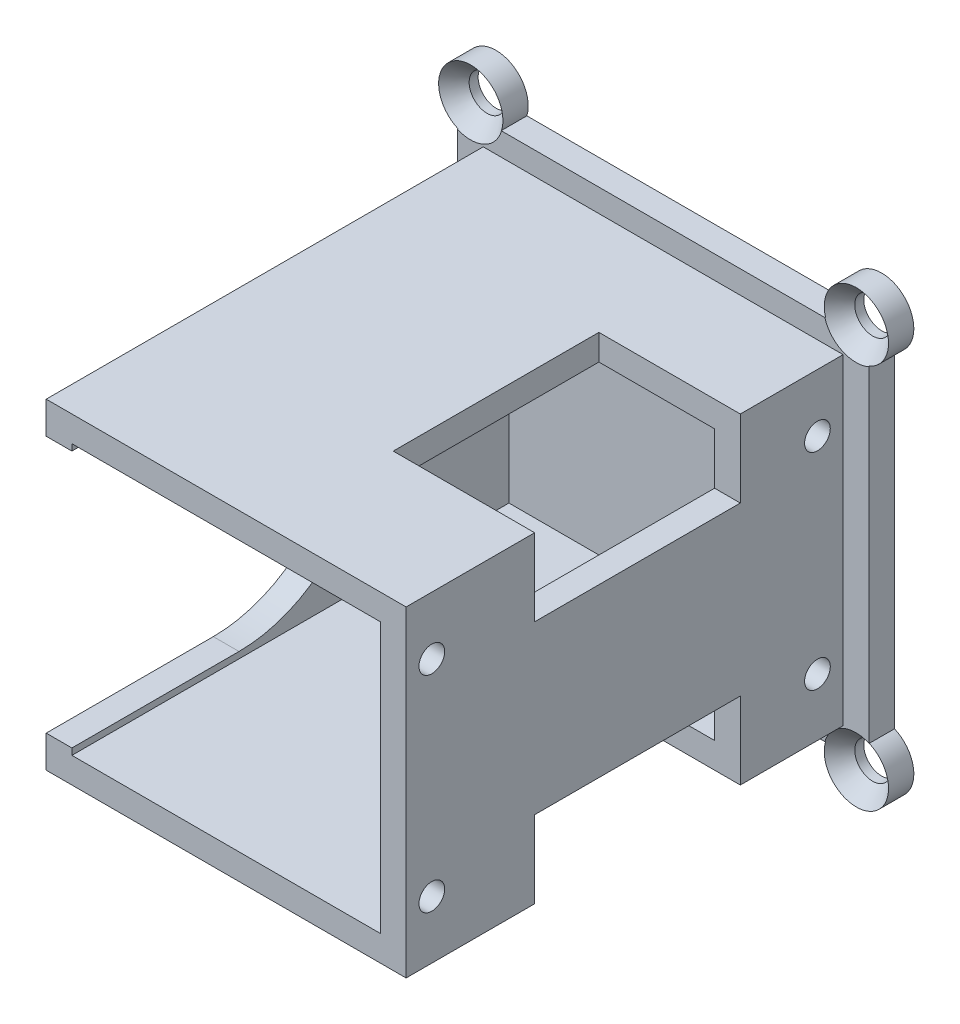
SolidWorks part; units mm, degrees
ref_plane "Ebene vorne" through (0, 0, 0) normal (0, 0, 1) x (1, 0, 0)
ref_plane "Ebene oben" through (0, 0, 0) normal (0, 1, 0) x (1, 0, 0)
ref_plane "Ebene rechts" through (0, 0, 0) normal (1, 0, 0) x (0, 0, -1)
sketch "Skizze1" plane through (0, 0, 0) normal (0, 0, 1) x (1, 0, 0)
  line L1 (-14, -12.5) -> (14, -12.5)
  line L2 (-14, -12.5) -> (-14, 12.5)
  line L3 (-14, 12.5) -> (14, 12.5)
  line L4 (14, -12.5) -> (14, 12.5)
  line L5 (-14, -12.5) -> (14, 12.5) construction
  line L6 (-14, 12.5) -> (14, -12.5) construction
  line L7 (-12, -10.5) -> (12, -10.5)
  line L8 (-12, -10.5) -> (-12, 10.5)
  line L9 (-12, 10.5) -> (12, 10.5)
  line L10 (12, -10.5) -> (12, 10.5)
  line L11 (-12, -10.5) -> (12, 10.5) construction
  line L12 (-12, 10.5) -> (12, -10.5) construction
  point P0 (0, 0)
  point P6 (0, 0)
  dimension "D1" = 2
  dimension "D2" = 2
  dimension "D3" = 24
  dimension "D4" = 21
extrude "Aufsatz-Linear austragen1" add sketch "Skizze1" along normal blind 36
sketch "Skizze2" plane through (0, 0, 0) normal (0, 0, 1) x (1, 0, 0)
  line L1 (-14, -12.5) -> (14, -12.5)
  line L2 (-14, -12.5) -> (-14, 12.5)
  line L3 (-14, 12.5) -> (14, 12.5)
  line L4 (14, -12.5) -> (14, 12.5)
  line L5 (-14, -12.5) -> (14, 12.5) construction
  line L6 (-14, 12.5) -> (14, -12.5) construction
  point P0 (0, 0)
extrude "Aufsatz-Linear austragen2" add sketch "Skizze2" along normal blind 2
sketch "Skizze4" plane through (0, 0, 0) normal (1, 0, 0) x (0, 0, -1)
  line L0 (-36, -12.5) -> (-36, 12.5) construction
  line L1 (-23, -10) -> (-36, -10)
  line L2 (-23, 10) -> (-36, 10)
  line L3 (-36, 10) -> (-36, -10)
  arc A0 (-23, -10) -> (-23, 10) centre (-23, 0) ccw
  dimension "D1" = 13
  dimension "D2" = 20
extrude "Schnitt-Linear austragen1" cut sketch "Skizze4" along normal up to surface (2 mm away) from surface at -14
sketch "Skizze6" plane through (0, 0, 0) normal (0, 0, 1) x (1, 0, 0)
  line L0 (-12.1518, -12.8474) -> (13.6136, 14.3929) construction
  line L1 (-13.9386, 12.4451) -> (13.9866, -12.488) construction
  line L2 (-15, 15) -> (15, -15) construction
  line L3 (15, 15) -> (-15, -15) construction
  line L4 (-15, -15) -> (15, -15) construction
  line L5 (-15, -15) -> (-15, 15) construction
  line L6 (-15, 15) -> (15, 15) construction
  line L7 (15, -15) -> (15, 15) construction
  circle A0 centre (-15, -15) radius 2.5
  point P2 (0, 0)
  dimension "D3" = 5
  dimension "D1" = 30
  dimension "D2" = 30
extrude "Aufsatz-Linear austragen3" add sketch "Skizze6" along normal blind 2
sketch "Skizze10" plane through (0, 0, 0) normal (0, 0, 1) x (1, 0, 0)
  line L0 (-14, 10) -> (-14, -10) construction
  line L1 (-16, -14.2857) -> (16, -14.2857)
  line L2 (-16, -14.2857) -> (-16, 14.2857)
  line L3 (-16, 14.2857) -> (16, 14.2857)
  line L4 (16, -14.2857) -> (16, 14.2857)
  line L5 (-16, -14.2857) -> (16, 14.2857) construction
  line L6 (-16, 14.2857) -> (16, -14.2857) construction
  point P0 (0, 0)
  dimension "D1" = 2
extrude "Aufsatz-Linear austragen4" add sketch "Skizze10" along normal blind 2
hole_wizard "Formsenkung für #3 Linsensenkschraube1" positions "3D-Skizze1" profile "Skizze8" countersink size "#3" standard "ANSI Inch"
sketch3d "3D-Skizze1"
  line L0 (-15, -15, 2) -> (-15, -15, 0) construction
  point P0 (-15, -15, 2)
sketch "Skizze8" plane through (-15, -15, 2) normal (1, 0, 0) x (0, -1, 0)
  line L0 (0, 0) -> (0, 2)
  line L1 (0, 2) -> (1.397, 2)
  line L2 (1.397, 2) -> (1.397, 1.3003)
  line L3 (1.397, 1.3003) -> (2.5273, 0)
  line L5 (2.5273, 0) -> (0, 0)
  line L6 (-1.397, 1.3003) -> (-2.5273, 0) construction
  line L11 (0, -6.35) -> (0, 107.95) construction
  dimension "Bohrerdurchmesser" = 2.794
  dimension "Bohrungstiefe" = 2
  dimension "Senkdurchmesser (Oben)" = 5.0546
  dimension "Senkwinkel (Oben)" = 82
mirror "Spiegeln6" about plane through (0, 0, 0) normal (1, 0, 0) of "Aufsatz-Linear austragen3", "Formsenkung für #3 Linsensenkschraube1"
sketch "Skizze12" plane through (0, 0, 0) normal (1, 0, 0) x (0, 0, -1)
  line L0 (-36, 12.5) -> (-2, 12.5) construction
  line L1 (-26, 12.5) -> (-10, 12.5)
  line L2 (-26, 12.5) -> (-26, 6.5)
  line L3 (-26, 6.5) -> (-10, 6.5)
  line L4 (-10, 12.5) -> (-10, 6.5)
  line L5 (-36, -12.5) -> (-36, 12.5) construction
  line L6 (-2, 12.5) -> (-2, -12.5) construction
  dimension "D1" = 6
  dimension "D2" = 10
  dimension "D3" = 8
extrude "Schnitt-Linear austragen2" cut sketch "Skizze12" against normal blind 11 from surface at 14
mirror "Spiegeln7" about plane through (0, 0, 0) normal (0, 1, 0) of "Schnitt-Linear austragen2"
sketch "Sketch1" plane through (14, 0, 0) normal (1, 0, 0) x (0, 0, -1)
  line L0 (-36, 0) -> (3.5916, 0) construction
  line L1 (-36, -12.5) -> (-36, 12.5) construction
  line L2 (-34, -8) -> (-34, 8) construction
  line L3 (-4, -8.0174) -> (-4, 8.0174) construction
  circle A0 centre (-34, 8) radius 1
  circle A1 centre (-34, -8) radius 1
  circle A2 centre (-4, 8.0174) radius 1
  circle A3 centre (-4, -8.0174) radius 1
  dimension "D1" = 2
  dimension "D2" = 16
  dimension "D3" = 2
  dimension "D4" = 30
extrude "Cut-Extrude1" cut sketch "Sketch1" against normal blind 10
